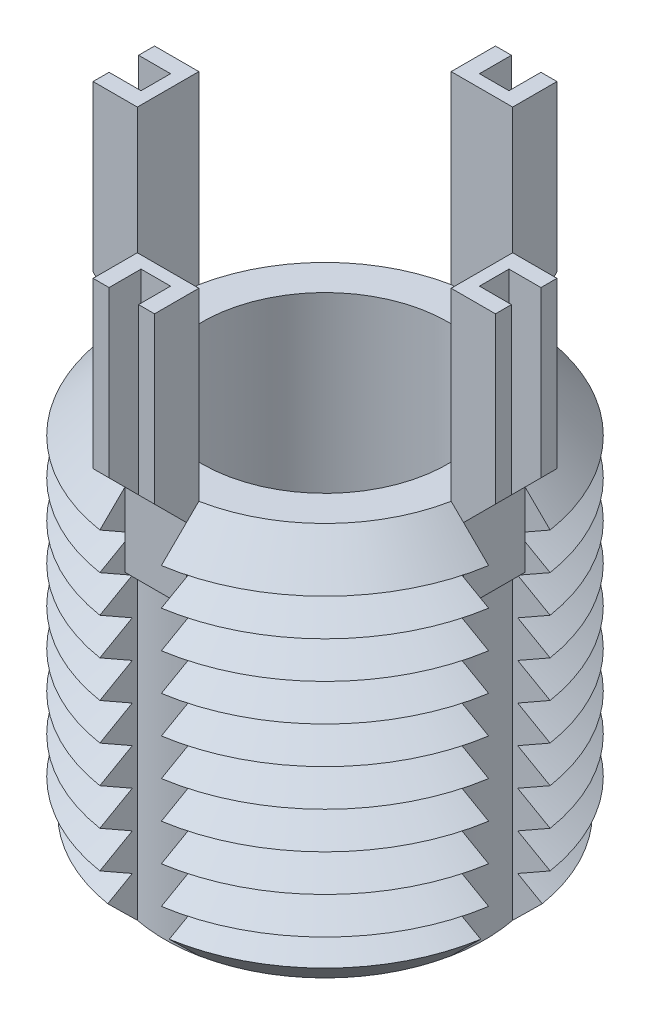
SolidWorks part; units mm, degrees
ref_plane "Front Plane" through (0, 0, 0) normal (0, 0, 1) x (1, 0, 0)
ref_plane "Top Plane" through (0, 0, 0) normal (0, 1, 0) x (1, 0, 0)
ref_plane "Right Plane" through (0, 0, 0) normal (1, 0, 0) x (0, 0, -1)
sketch "Sketch1" plane through (0, 0, 0) normal (0, 1, 0) x (1, 0, 0)
  circle A0 centre (0, 0) radius 8
  dimension "D1" = 16
extrude "Boss-Extrude1" add sketch "Sketch1" against normal blind 16
chamfer "Chamfer1" distance 1.5 angle 45 2 edges at (0, -16, 8) (0, 0, 8)
sketch "Sketch2" plane through (0, 0, 0) normal (1, 0, 0) x (0, 0, -1)
  line L0 (0, 0.8859) -> (0, -9.2617) construction
sketch "Sketch3" plane through (0, 0, 0) normal (1, 0, 0) x (0, 0, -1)
  line L0 (-8, -1.5) -> (-6.701, -2.25)
  line L1 (-6.701, -2.25) -> (-8, -3)
  line L2 (-8, -1.5) -> (-8, -14.5) construction
  line L3 (-8, -3) -> (-8, -1.5)
  dimension "D1" = 1.5
revolve "Cut-Revolve1" cut sketch "Sketch3" angle 360 about L0
pattern_linear "LPattern1" count 9 spacing 1.5 along (0, -1, 0) of "Cut-Revolve1"
sketch "Sketch4" plane through (0, 0, 0) normal (0, 1, 0) x (1, 0, 0)
  line L0 (-6.3787, 1.25) -> (-7.9017, 1.25)
  line L2 (-7.9017, -1.25) -> (-6.3787, -1.25)
  arc A0 (-6.3787, 1.25) -> (-6.3787, -1.25) centre (0, 0) ccw
  arc A1 (-7.9017, 1.25) -> (-7.9017, -1.25) centre (0, 0) ccw
  circle A2 centre (0, 0) radius 8 construction
  circle A3 centre (0, 0) radius 6.5 construction
  point P1 (-6.5, 0)
  point P3 (-8, 0)
  point P13 (0, 0)
  dimension "D1" = 2.5
extrude "Cut-Extrude1" cut sketch "Sketch4" against normal up to surface (16 mm away)
pattern_circular "CirPattern1" count 4 over 360 about axis through (0, 0, 0) along (0, 1, 0) of "Cut-Extrude1"
sketch "Sketch5" plane through (0, 0, 0) normal (1, 0, 0) x (0, 0, -1)
  line L0 (-6.3787, 7.5) -> (-6.3787, -3.5)
  line L1 (-6.3787, -3.5) -> (-6.8787, -3.5)
  line L2 (-6.8787, -3.5) -> (-6.8787, -0.5)
  line L3 (-6.8787, -0.5) -> (-8.1787, 0.8)
  line L4 (-8.1787, 0.8) -> (-8.1787, 7.5)
  line L5 (-8.1787, 7.5) -> (-6.3787, 7.5)
  line L6 (-7.9017, -4.5) -> (-1.25, -4.5) construction
  point P9 (-1.25, 0)
  point P10 (-6.8787, -0.5)
  dimension "D1" = 1
  dimension "D2" = 11
  dimension "D3" = 8
  dimension "D4" = 1.8
  dimension "D5" = 0.5
  dimension "D6" = 45
extrude "Boss-Extrude3" add sketch "Sketch5" along normal mid plane 2.5
pattern_circular "CirPattern2" count 4 over 360 about axis through (0, 0, 0) along (0, 1, 0) of "Boss-Extrude3"
sketch "Sketch6" plane through (0, 7.5, 0) normal (0, 1, 0) x (1, 0, 0)
  line L0 (-8.1787, -1.25) -> (-8.1787, 1.25) construction
  line L1 (-8.1787, -0.6) -> (-6.8787, -0.6)
  line L2 (-8.1787, -0.6) -> (-8.1787, 0.6)
  line L3 (-8.1787, 0.6) -> (-6.8787, 0.6)
  line L4 (-6.8787, -0.6) -> (-6.8787, 0.6)
  line L5 (-8.1787, -0.6) -> (-6.8787, 0.6) construction
  line L6 (-8.1787, 0.6) -> (-6.8787, -0.6) construction
  line L7 (8.1787, 1.25) -> (8.1787, -1.25) construction
  line L8 (-0.6, 6.8787) -> (0.6, 6.8787)
  line L9 (-0.6, 6.8787) -> (-0.6, 8.1787)
  line L10 (-0.6, 8.1787) -> (0.6, 8.1787)
  line L11 (0.6, 6.8787) -> (0.6, 8.1787)
  line L12 (-0.6, 6.8787) -> (0.6, 8.1787) construction
  line L13 (-0.6, 8.1787) -> (0.6, 6.8787) construction
  line L14 (6.8787, -0.6) -> (8.1787, -0.6)
  line L15 (6.8787, -0.6) -> (6.8787, 0.6)
  line L16 (6.8787, 0.6) -> (8.1787, 0.6)
  line L17 (8.1787, -0.6) -> (8.1787, 0.6)
  line L18 (6.8787, -0.6) -> (8.1787, 0.6) construction
  line L19 (6.8787, 0.6) -> (8.1787, -0.6) construction
  line L20 (-0.6, -8.1787) -> (0.6, -8.1787)
  line L21 (-0.6, -8.1787) -> (-0.6, -6.8787)
  line L22 (-0.6, -6.8787) -> (0.6, -6.8787)
  line L23 (0.6, -8.1787) -> (0.6, -6.8787)
  line L24 (-0.6, -8.1787) -> (0.6, -6.8787) construction
  line L25 (-0.6, -6.8787) -> (0.6, -8.1787) construction
  line L26 (-1.25, 8.1787) -> (1.25, 8.1787) construction
  line L27 (1.25, -8.1787) -> (-1.25, -8.1787) construction
  point P0 (-7.5287, 0)
  point P7 (-8.1787, 0)
  point P8 (-8.1787, 0)
  point P9 (0, 7.5287)
  point P14 (7.5287, 0)
  point P19 (0, -7.5287)
  point P24 (0, 8.1787)
  point P25 (8.1787, 0)
  point P26 (8.1787, 0)
  point P27 (0, 8.1787)
  point P30 (0, -8.1787)
  point P33 (0, -8.1787)
  dimension "D1" = 1.2
  dimension "D2" = 1.3
extrude "Cut-Extrude3" cut sketch "Sketch6" against normal through all both and the other way through all
sketch "Sketch7" plane through (0, 0, 0) normal (0, 1, 0) x (1, 0, 0)
  circle A0 centre (0, 0) radius 5
  dimension "D1" = 10
extrude "Cut-Extrude4" cut sketch "Sketch7" against normal up to surface (16 mm away)
